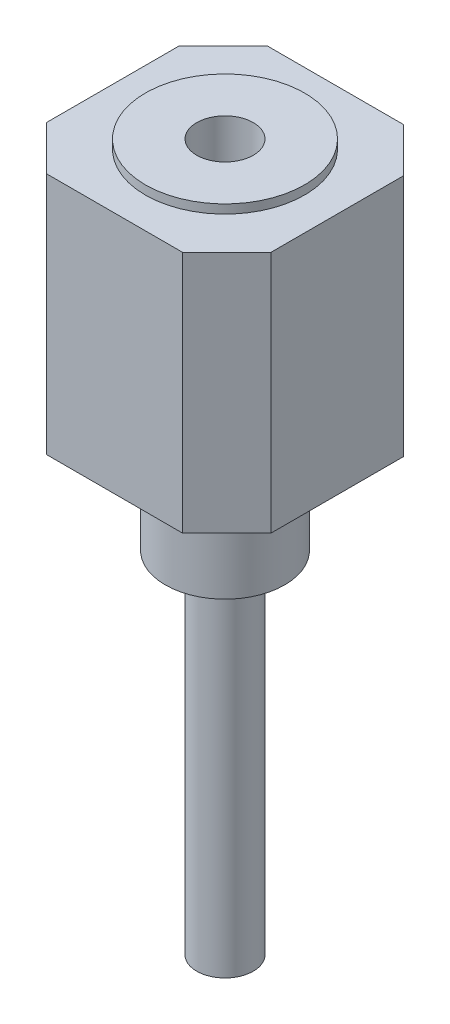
SolidWorks part; units mm, degrees
ref_plane "Plan de face" through (0, 0, 0) normal (0, 0, 1) x (1, 0, 0)
ref_plane "Plan de dessus" through (0, 0, 0) normal (0, 1, 0) x (1, 0, 0)
ref_plane "Plan de droite" through (0, 0, 0) normal (1, 0, 0) x (0, 0, -1)
sketch "Esquisse1" plane through (0, 0, 0) normal (0, 1, 0) x (1, 0, 0)
  line L0 (0, -7.9509) -> (0, 2.8008) construction
  line L1 (-2.171, 1.25) -> (5.4216, 1.25) construction
  line L2 (-2.171, -1.25) -> (5.4216, -1.25) construction
  line L3 (-9.575, 0) -> (3.9061, 0) construction
  line L4 (-1.27, -2.1606) -> (-1.27, 3.9067) construction
  line L5 (1.27, -2.1606) -> (1.27, 3.9067) construction
  line L6 (-0.77, 1.7646) -> (-0.77, 0.891) construction
  line L7 (-2.171, 0.75) -> (-0.5875, 0.75) construction
  line L8 (-1.27, 0.75) -> (-0.77, 1.25)
  line L9 (1.27, 0.75) -> (0.77, 1.25)
  line L10 (1.27, -0.75) -> (0.77, -1.25)
  line L11 (-1.27, -0.75) -> (-0.77, -1.25)
  line L12 (-1.27, 0.75) -> (-1.27, -0.75)
  line L13 (-0.77, -1.25) -> (0.77, -1.25)
  line L14 (1.27, -0.75) -> (1.27, 0.75)
  line L15 (-0.77, 1.25) -> (0.77, 1.25)
  dimension "D1" = 2.5
  dimension "D2" = 1.25
  dimension "D3" = 2.54
  dimension "D4" = 1.27
  dimension "D5" = 0.5
  dimension "D6" = 0.5
extrude "Boss.-Extru.1" add sketch "Esquisse1" along normal blind 2.75
sketch "Esquisse2" plane through (0, 2.75, 0) normal (0, 1, 0) x (1, 0, 0)
  circle A0 centre (0, 0) radius 0.9
extrude "Boss.-Extru.2" add sketch "Esquisse2" along normal blind 0.1
sketch "Esquisse3" plane through (0, 0, 0) normal (0, -1, 0) x (1, 0, 0)
  circle A0 centre (0, 0) radius 0.675
extrude "Boss.-Extru.3" add sketch "Esquisse3" along normal blind 1.18
sketch "Esquisse4" plane through (0, -1.18, 0) normal (0, -1, 0) x (1, 0, 0)
  circle A0 centre (0, 0) radius 0.32
extrude "Boss.-Extru.4" add sketch "Esquisse4" along normal blind 3.96
sketch "Esquisse5" plane through (0, 2.85, 0) normal (0, 1, 0) x (1, 0, 0)
  circle A0 centre (0, 0) radius 0.32
extrude "Enlèv. mat.-Extru.1" cut sketch "Esquisse5" against normal blind 3.8
